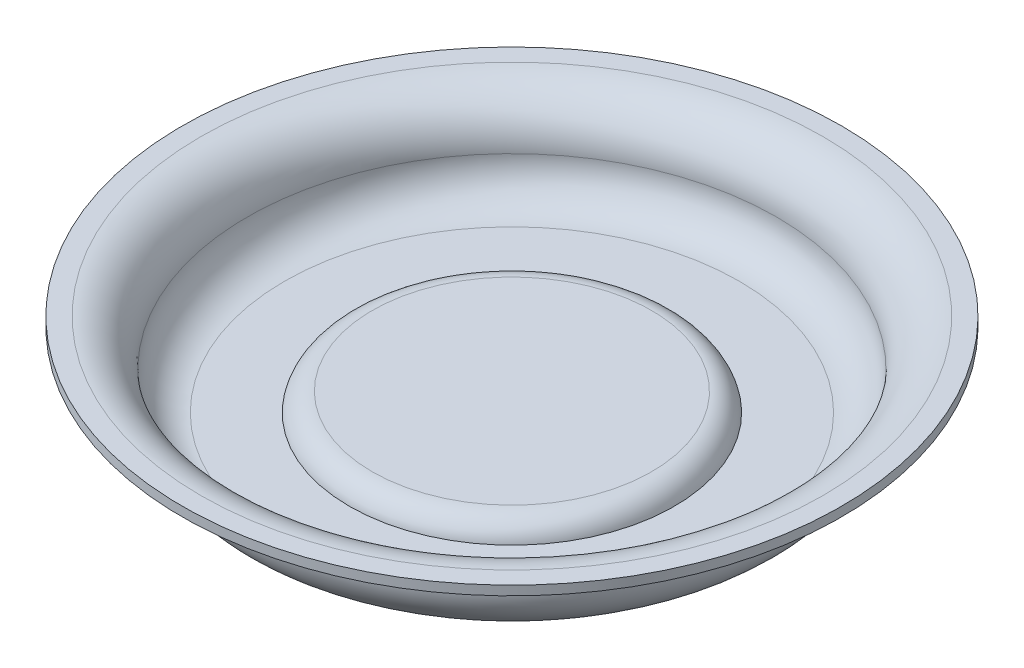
SolidWorks part; units mm, degrees
ref_plane "Face" through (0, 0, 0) normal (0, 0, 1) x (1, 0, 0)
ref_plane "Dessus" through (0, 0, 0) normal (0, 1, 0) x (1, 0, 0)
ref_plane "Droite" through (0, 0, 0) normal (1, 0, 0) x (0, 0, -1)
sketch "Esquisse1" plane through (0, 0, 0) normal (0, 0, 1) x (1, 0, 0)
  line L0 (0, 0) -> (29.5, 0)
  line L1 (29.5, 0) -> (29.5, 9)
  line L2 (29.5, 9) -> (35.5, 9)
  line L3 (35.5, 9) -> (35.5, 10)
  line L4 (35.5, 10) -> (28.5, 10)
  line L5 (28.5, 10) -> (28.5, 1)
  line L6 (28.5, 1) -> (0, 1)
  line L7 (0, 0) -> (0, 5.0342) construction
  line L8 (0, 0) -> (0, 1)
  dimension "D1" = 1
  dimension "D2" = 1
  dimension "D3" = 1
  dimension "D4" = 29.5
  dimension "D5" = 9
  dimension "D6" = 35.5
revolve "Base-Révolution" add sketch "Esquisse1" angle 360 about L7
fillet "Congé2" radius 4
fillet "Congé3" radius 5
fillet "Congé4" radius 4
fillet "Congé5" radius 5
sketch "Esquisse2" plane through (0, 1, 0) normal (0, 1, 0) x (-1, 0, 0)
  circle A0 centre (0, 0) radius 17.5
  dimension "D1" = 35
extrude "Boss.-Extru.1" add sketch "Esquisse2" along normal blind 2
fillet "Congé6" radius 2.5
sketch "Esquisse3" plane through (0, 0, 0) normal (0, -1, 0) x (1, 0, 0)
  circle A0 centre (0, 0) radius 16.5
  dimension "D1" = 33
extrude "Enlèv. mat.-Extru.1" cut sketch "Esquisse3" against normal blind 2
fillet "Congé7" radius 1.5
sketch "Esquisse4" plane through (0, 3, 0) normal (0, 1, 0) x (-1, 0, 0)
  circle A0 centre (0, 0) radius 1.5
  dimension "D1" = 3
